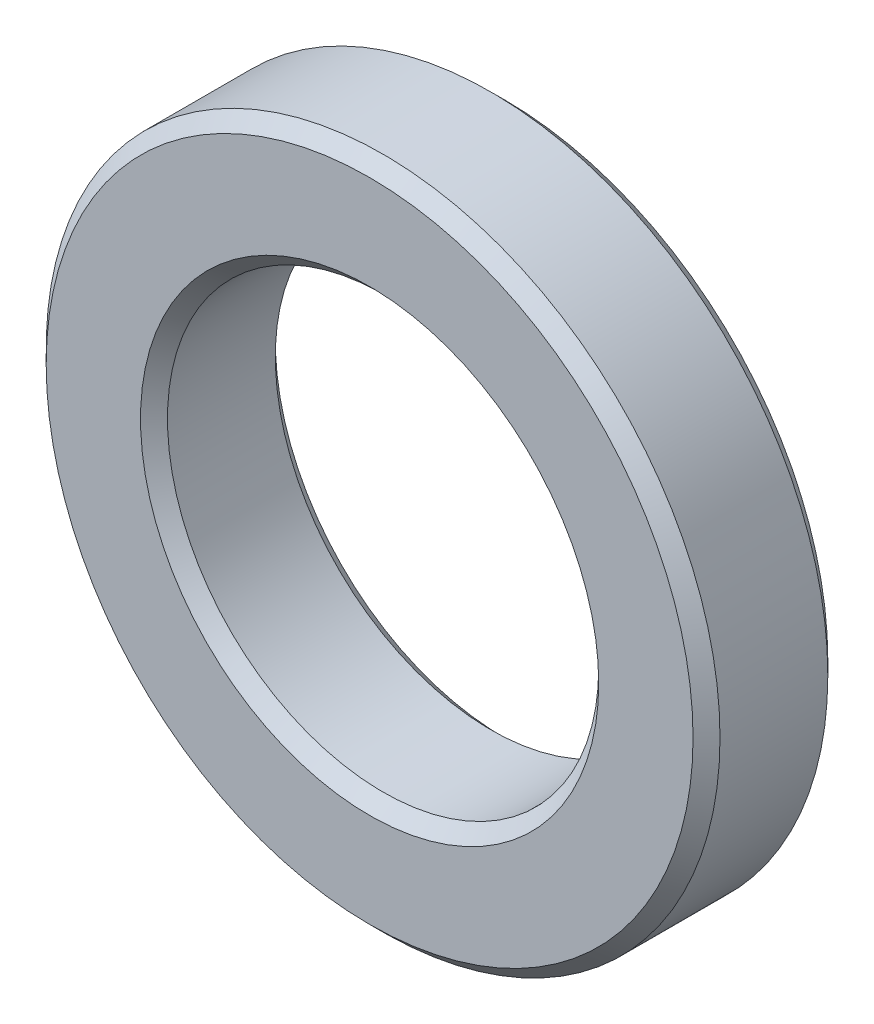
SolidWorks part; units mm, degrees
ref_plane "Front Plane" through (0, 0, 0) normal (0, 0, 1) x (1, 0, 0)
ref_plane "Top Plane" through (0, 0, 0) normal (0, 1, 0) x (1, 0, 0)
ref_plane "Right Plane" through (0, 0, 0) normal (1, 0, 0) x (0, 0, -1)
sketch "Sketch1" plane through (0, 0, 0) normal (0, 0, 1) x (1, 0, 0)
  circle A0 centre (0, 0) radius 5
  circle A1 centre (0, 0) radius 3.2
  dimension "D1" = 10
  dimension "D2" = 6.4
extrude "Boss-Extrude2" add sketch "Sketch1" along normal mid plane 2
chamfer "Chamfer3" distance 0.2 angle 45 4 edges at (5, 0, 1) (5, 0, -1) (3.2, 0, -1) (3.2, 0, 1)
